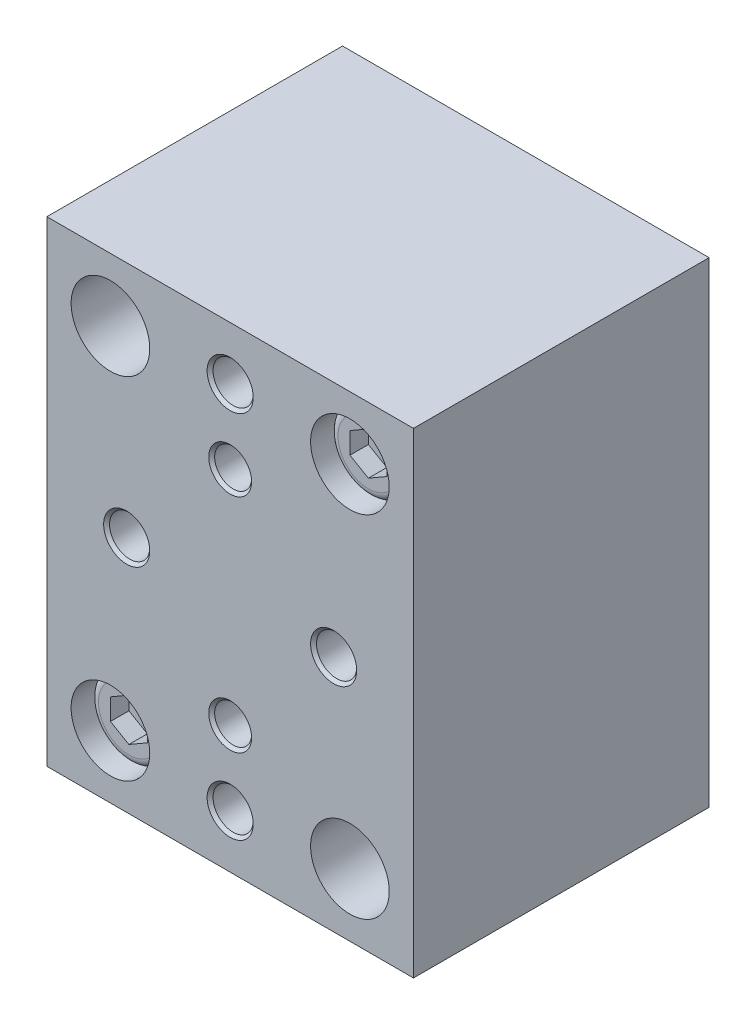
SolidWorks part; units mm, degrees
ref_plane "Front Plane" through (0, 0, 0) normal (0, 0, 1) x (1, 0, 0)
ref_plane "Top Plane" through (0, 0, 0) normal (0, 1, 0) x (1, 0, 0)
ref_plane "Right Plane" through (0, 0, 0) normal (1, 0, 0) x (0, 0, -1)
sketch "Sketch1" plane through (0, 0, 0) normal (0, 0, 1) x (1, 0, 0)
  line L0 (-15.748, 20.447) -> (15.748, -20.447) construction
  line L1 (-15.748, 20.447) -> (15.748, 20.447)
  line L2 (-15.748, 20.447) -> (-15.748, -20.447)
  line L3 (-15.748, -20.447) -> (15.748, -20.447)
  line L4 (15.748, 20.447) -> (15.748, -20.447)
  dimension "D1" = 31.496
  dimension "D2" = 40.894
extrude "Extrude1" add sketch "Sketch1" along normal blind 25.4
sketch "Sketch2" plane through (0, 0, 25.4) normal (0, 0, 1) x (1, 0, 0)
  line L0 (-10.287, 15.0495) -> (10.287, -15.0495) construction
  circle A0 centre (-10.287, 15.0495) radius 3.3782
  circle A1 centre (10.287, 15.0495) radius 3.3782
  circle A2 centre (-10.287, -15.0495) radius 3.3782
  circle A3 centre (10.287, -15.0495) radius 3.3782
  dimension "D1" = 6.7564
  dimension "D2" = 20.574
  dimension "D3" = 30.099
extrude "Cut-Extrude1" cut sketch "Sketch2" against normal through all
hole_wizard "Hole1" positions "Sketch4" profile "Sketch3" legacy
sketch "Sketch4" plane through (0, 0, 0) normal (0, 0, -1) x (-1, 0, 0)
  line L0 (0, 9.525) -> (0, -9.525) construction
  point P0 (0, 9.525)
  point P2 (0, -9.525)
  dimension "D1" = 19.05
sketch "Sketch3" plane through (0, 9.525, 0) normal (1, 0, 0) x (0, 1, 0)
  line L0 (0, 0) -> (0, 25.4)
  line L1 (0, 25.4) -> (1.5875, 25.4)
  line L2 (1.5875, 25.4) -> (1.5875, 3.175)
  line L3 (1.5875, 3.175) -> (2.9845, 3.175)
  line L4 (2.9845, 3.175) -> (2.9845, 0)
  line L5 (2.9845, 0) -> (0, 0)
  line L6 (0, 110) -> (0, -10) construction
  dimension "Diameter" = 3.175
  dimension "Depth" = 25.4
  dimension "C-Bore Diameter" = 5.969
  dimension "C-Bore Depth" = 3.175
hole_wizard "#8-32 Tapped Hole1" positions "Sketch6" profile "Sketch5" tap size "#8-32" standard "ANSI Inch"
sketch "Sketch6" plane through (0, 0, 25.4) normal (0, 0, 1) x (1, 0, 0)
  line L0 (0, 15.875) -> (0, -15.875) construction
  line L2 (-8.89, 0) -> (8.89, 0) construction
  point P0 (-8.89, 0)
  point P2 (8.89, 0)
  point P4 (0, 15.875)
  point P6 (0, -15.875)
  dimension "D1" = 31.75
  dimension "D2" = 17.78
sketch "Sketch5" plane through (-8.89, 0, 25.4) normal (1, 0, 0) x (0, -1, 0)
  line L0 (0, 0) -> (0, 25.4)
  line L1 (0, 25.4) -> (1.7272, 25.4)
  line L2 (1.7272, 25.4) -> (1.7272, 0)
  line L5 (1.7272, 0) -> (0, 0)
  line L11 (0, -6.35) -> (0, 107.95) construction
  dimension "Thru Tap Drill Dia." = 3.4544
  dimension "Thru Tap Drill Depth" = 25.4
sketch "Sketch7" plane through (0, 0, 0) normal (0, 0, -1) x (-1, 0, 0)
  circle A4 centre (-10.287, 15.0495) radius 3.3782 construction
  circle A5 centre (-10.287, 15.0495) radius 3.3782
  circle A6 centre (10.287, -15.0495) radius 3.3782 construction
  circle A7 centre (10.287, -15.0495) radius 3.3782
extrude "Boss-Extrude1" add sketch "Sketch7" against normal offset from surface (23.8125 mm away) 1.5875 separate body
fillet "Fillet1" radius 0.762 1 edges at (13.6652, 15.0495, 23.8125)
fillet "Fillet2" radius 0.762 1 edges at (-6.9088, -15.0495, 23.8125)
sketch "Sketch8" plane through (0, 0, 23.8125) normal (0, 0, 1) x (1, 0, 0)
  line L1 (10.287, 16.8826) -> (8.6995, 15.966)
  line L2 (8.6995, 15.966) -> (8.6995, 14.133)
  line L3 (8.6995, 14.133) -> (10.287, 13.2164)
  line L4 (10.287, 13.2164) -> (11.8745, 14.133)
  line L5 (11.8745, 14.133) -> (11.8745, 15.966)
  line L6 (11.8745, 15.966) -> (10.287, 16.8826)
  line L7 (-10.287, -13.2164) -> (-11.8745, -14.133)
  line L8 (-11.8745, -14.133) -> (-11.8745, -15.966)
  line L9 (-11.8745, -15.966) -> (-10.287, -16.8826)
  line L10 (-10.287, -16.8826) -> (-8.6995, -15.966)
  line L11 (-8.6995, -15.966) -> (-8.6995, -14.133)
  line L12 (-8.6995, -14.133) -> (-10.287, -13.2164)
  circle A0 centre (10.287, 15.0495) radius 1.5875 construction
  circle A1 centre (-10.287, -15.0495) radius 1.5875 construction
  circle A2 centre (10.287, 15.0495) radius 2.6162 construction
  circle A3 centre (-10.287, -15.0495) radius 2.6162 construction
  dimension "D1" = 3.175
extrude "Cut-Extrude2" cut sketch "Sketch8" against normal blind 1.5875
chamfer "Chamfer1" distance 0.254 angle 45 6 edges at (-7.1628, 0, 25.4) (10.6172, 0, 25.4) (1.7272, -15.875, 25.4) (-1.5875, -9.525, 25.4) (1.7272, 15.875, 25.4) (-1.5875, 9.525, 25.4)
